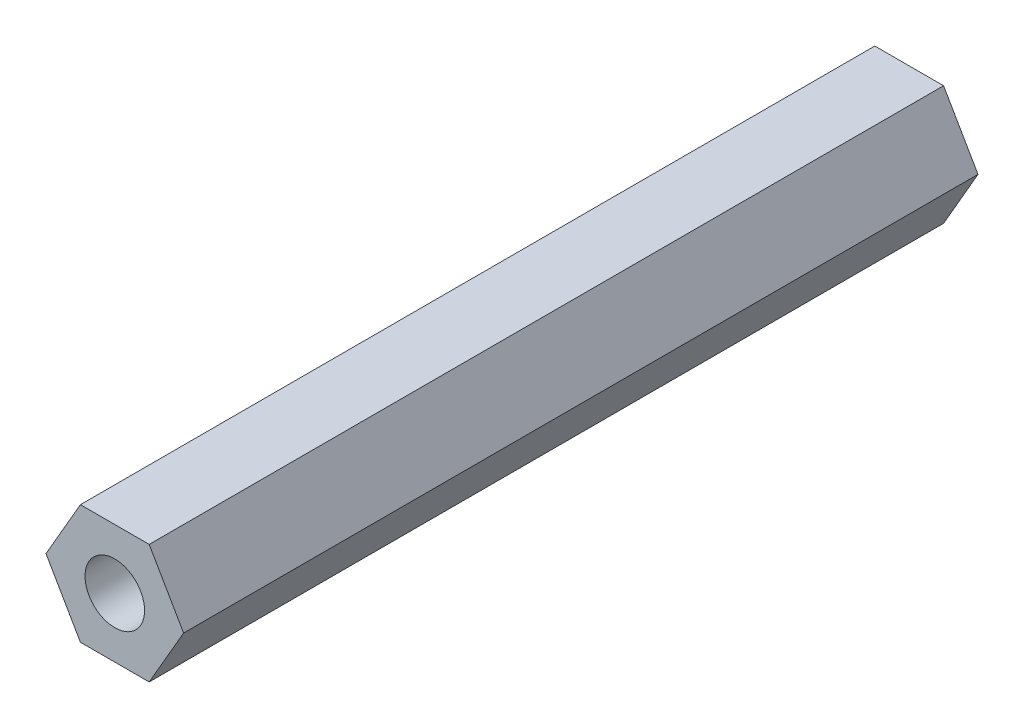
SolidWorks part; units mm, degrees
ref_plane "前视基准面" through (0, 0, 0) normal (0, 0, 1) x (1, 0, 0)
ref_plane "上视基准面" through (0, 0, 0) normal (0, 1, 0) x (1, 0, 0)
ref_plane "右视基准面" through (0, 0, 0) normal (1, 0, 0) x (0, 0, -1)
other "Configuration Table"
sketch "草图1" plane through (0, 0, 0) normal (0, 0, 1) x (1, 0, 0)
  line L1 (3.4641, 0) -> (1.7321, 3)
  line L2 (1.7321, 3) -> (-1.7321, 3)
  line L3 (-1.7321, 3) -> (-3.4641, 0)
  line L4 (-3.4641, 0) -> (-1.7321, -3)
  line L5 (-1.7321, -3) -> (1.7321, -3)
  line L6 (1.7321, -3) -> (3.4641, 0)
  circle A0 centre (0, 0) radius 3 construction
  circle A1 centre (0, 0) radius 1.5
  dimension "D1" = 6
  dimension "D2" = 3
extrude "凸台-拉伸1" add sketch "草图1" along normal mid plane 40
